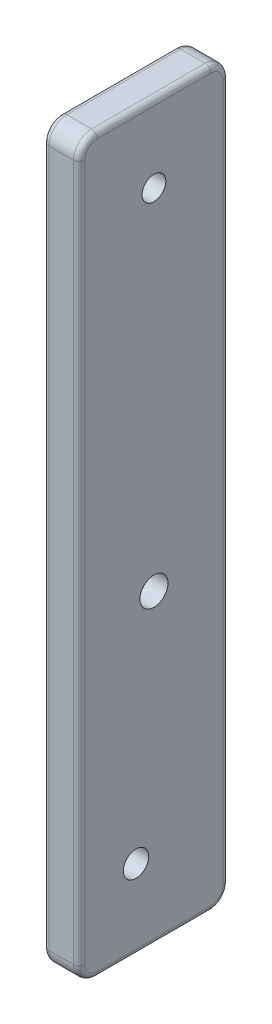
SolidWorks part; units mm, degrees
ref_plane "Front Plane" through (0, 0, 0) normal (0, 0, 1) x (1, 0, 0)
ref_plane "Top Plane" through (0, 0, 0) normal (0, 1, 0) x (1, 0, 0)
ref_plane "Right Plane" through (0, 0, 0) normal (1, 0, 0) x (0, 0, -1)
sketch "Sketch2" plane through (0, 0, 0) normal (1, 0, 0) x (0, 0, -1)
  line L0 (0, 20.35) -> (0, -20.35) construction
  line L10 (-10.05, 20.35) -> (10.05, 20.35)
  line L15 (-10.05, 20.35) -> (-10.05, -20.35)
  line L16 (-10.05, -20.35) -> (10.05, -20.35)
  line L17 (10.05, 20.35) -> (10.05, -20.35)
  line L18 (-10.05, 20.35) -> (10.05, -20.35) construction
  line L19 (-10.05, -20.35) -> (10.05, 20.35) construction
  line L20 (-10.05, 0) -> (10.05, 0) construction
  line L21 (-10.05, 20.35) -> (-10.05, 33.05)
  line L22 (-10.05, 33.05) -> (16.4, 33.05)
  line L23 (16.4, 33.05) -> (16.4, -96.55)
  line L24 (16.4, -96.55) -> (-10.05, -96.55)
  line L25 (-10.05, -96.55) -> (-10.05, -20.35)
  point P0 (0, 0)
  dimension "D1" = 20.1
  dimension "D2" = 40.7
  dimension "D3" = 6.35
  dimension "D4" = 12.7
  dimension "D5" = 76.2
extrude "Boss-Extrude2" add sketch "Sketch2" along normal blind 6.35
sketch "Sketch8" plane through (6.35, 0, 0) normal (1, 0, 0) x (0, 0, -1)
  line L0 (0, 0) -> (0, 20.35) construction
  line L1 (-10.05, 20.35) -> (10.05, 20.35) construction
  line L2 (0, 0) -> (10.05, 0) construction
  line L3 (10.05, 20.35) -> (10.05, -20.35) construction
  circle A0 centre (-4.75, 24.5) radius 2.25
  circle A1 centre (4.75, 24.5) radius 2.25
  circle A2 centre (4.75, -24.5) radius 2.25
  circle A3 centre (-4.75, -24.5) radius 2.25
  dimension "D3" = 4.5
  dimension "D1" = 4.75
  dimension "D2" = 24.5
extrude "Cut-Extrude3" cut sketch "Sketch8" against normal through all
sketch "Sketch10" plane through (6.35, 0, 0) normal (1, 0, 0) x (0, 0, -1)
  line L0 (-10.05, -20.35) -> (10.05, -20.35) construction
  line L1 (0, -20.35) -> (0, -58.45) construction
  line L2 (0, -58.45) -> (0, -62.45) construction
  line L3 (0, -62.45) -> (0, -82.45) construction
  circle A0 centre (0, -58.45) radius 1.55
  circle A1 centre (0, -62.45) radius 1.55
  circle A2 centre (0, -82.45) radius 1.55
  point P0 (0, -20.35)
  dimension "D2" = 3.1
  dimension "D3" = 3.1
  dimension "D5" = 3.1
  dimension "D1" = 38.1
  dimension "D4" = 4
  dimension "D6" = 20
extrude "Cut-Extrude4" cut sketch "Sketch10" against normal through all
fillet "Fillet2" radius 3.175 4 edges at (3.175, -96.55, -16.4) (3.175, -96.55, 10.05) (3.175, 33.05, 10.05) (3.175, 33.05, -16.4)
sketch "Sketch11" plane through (6.35, 0, 0) normal (1, 0, 0) x (0, 0, -1)
  line L0 (13.225, -96.55) -> (-6.875, -96.55) construction
  circle A0 centre (3.175, -42.2876) radius 2.4812
  point P0 (3.175, -96.55)
  dimension "D1" = 4.9625
  dimension "D2" = 54.2624
extrude "Cut-Extrude5" cut sketch "Sketch11" against normal through all
sketch "Sketch12" plane through (6.35, 0, 0) normal (1, 0, 0) x (0, 0, -1)
  circle A0 centre (0, -82.45) radius 2.25
  dimension "D1" = 4.5
extrude "Cut-Extrude6" cut sketch "Sketch12" against normal through all
sketch "Sketch13" plane through (0, 20.35, 0) normal (0, -1, 0) x (1, 0, 0)
  line L1 (0, 10.05) -> (6.35, 10.05)
  line L2 (0, 10.05) -> (0, -10.05)
  line L3 (0, -10.05) -> (6.35, -10.05)
  line L4 (6.35, 10.05) -> (6.35, -10.05)
extrude "Boss-Extrude3" add sketch "Sketch13" against normal blind 7.62
sketch "Sketch14" plane through (0, 20.35, 0) normal (0, -1, 0) x (1, 0, 0)
  line L1 (0, 10.05) -> (6.35, 10.05)
  line L2 (0, 10.05) -> (0, -10.05)
  line L3 (0, -10.05) -> (6.35, -10.05)
  line L4 (6.35, 10.05) -> (6.35, -10.05)
extrude "Boss-Extrude4" add sketch "Sketch14" along normal blind 50.8
sketch "Sketch15" plane through (0, 0, 10.05) normal (0, 0, 1) x (1, 0, 0)
  line L0 (0, -93.375) -> (0, 29.875) construction
  line L1 (0, -69.9761) -> (6.35, -69.9761)
  line L2 (0, -69.9761) -> (0, -52.349)
  line L3 (0, -52.349) -> (6.35, -52.349)
  line L4 (6.35, -69.9761) -> (6.35, -52.349)
  line L5 (6.35, -93.375) -> (6.35, 29.875) construction
extrude "Boss-Extrude5" add sketch "Sketch15" against normal up to surface (26.45 mm away)
fillet "Fillet7" radius 1 16 edges at (6.35, -95.6201, 9.1201) (0, -95.6201, 9.1201) (6.35, -95.6201, -15.4701) (0, -95.6201, -15.4701) (0, -96.55, -3.175) (6.35, -96.55, -3.175) (6.35, -31.75, -16.4) (0, -31.75, -16.4) (6.35, 32.1201, -15.4701) (0, 32.1201, -15.4701) (6.35, 33.05, -3.175) (0, 33.05, -3.175) (6.35, 32.1201, 9.1201) (0, 32.1201, 9.1201) (0, -31.75, 10.05) (6.35, -31.75, 10.05)
sketch "Sketch16" plane through (6.35, 0, 0) normal (1, 0, 0) x (0, 0, -1)
  line L0 (13.225, -96.55) -> (-6.875, -96.55) construction
  line L1 (-6.875, -95.55) -> (13.225, -95.55) construction
  circle A0 centre (3.175, 19.48) radius 2.1
  point P4 (3.175, -95.55)
  dimension "D2" = 4.2
  dimension "D1" = 116.03
extrude "Cut-Extrude7" cut sketch "Sketch16" against normal through all
sketch "Sketch17" plane through (0, 0, 0) normal (-1, 0, 0) x (0, 0, 1)
  circle A0 centre (0, -82.45) radius 4.6
  dimension "D1" = 9.2
extrude "Cut-Extrude8" cut sketch "Sketch17" against normal blind 1.5875
